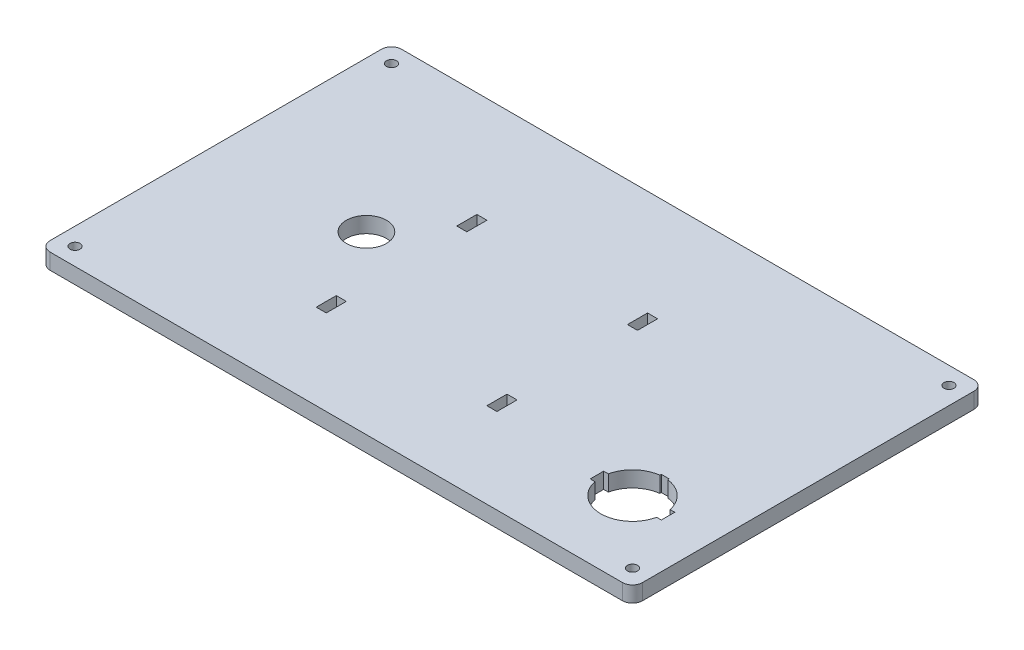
SolidWorks part; units mm, degrees
ref_plane "Front Plane" through (0, 0, 0) normal (0, 0, 1) x (1, 0, 0)
ref_plane "Top Plane" through (0, 0, 0) normal (0, 1, 0) x (1, 0, 0)
ref_plane "Right Plane" through (0, 0, 0) normal (1, 0, 0) x (0, 0, -1)
sketch "Sketch1" plane through (0, 0, 0) normal (0, 1, 0) x (1, 0, 0)
  line L1 (-90.4875, 55.5625) -> (90.4875, 55.5625)
  line L2 (-93.6625, 52.3875) -> (-93.6625, -52.3875)
  line L3 (-90.4875, -55.5625) -> (90.4875, -55.5625)
  line L4 (93.6625, 52.3875) -> (93.6625, -52.3875)
  line L5 (-93.6625, 55.5625) -> (93.6625, -55.5625) construction
  line L6 (-93.6625, -55.5625) -> (93.6625, 55.5625) construction
  line L7 (-88.138, 50.038) -> (88.138, 50.038) construction
  line L8 (-88.138, 50.038) -> (-88.138, -50.038) construction
  line L9 (-88.138, -50.038) -> (88.138, -50.038) construction
  line L10 (88.138, 50.038) -> (88.138, -50.038) construction
  line L11 (-88.138, 50.038) -> (88.138, -50.038) construction
  line L12 (-88.138, -50.038) -> (88.138, 50.038) construction
  circle A0 centre (-88.138, 50.038) radius 1.5875
  circle A1 centre (-88.138, -50.038) radius 1.5875
  circle A2 centre (88.138, -50.038) radius 1.5875
  circle A3 centre (88.138, 50.038) radius 1.5875
  arc A4 (-93.6625, -52.3875) -> (-90.4875, -55.5625) centre (-90.4875, -52.3875) ccw
  arc A5 (90.4875, -55.5625) -> (93.6625, -52.3875) centre (90.4875, -52.3875) ccw
  arc A6 (90.4875, 55.5625) -> (93.6625, 52.3875) centre (90.4875, 52.3875) cw
  arc A7 (-90.4875, 55.5625) -> (-93.6625, 52.3875) centre (-90.4875, 52.3875) ccw
  point P0 (0, 0)
  point P5 (0, 0)
  dimension "D5" = 3.175
  dimension "D6" = 3.175
  dimension "D1" = 111.125
  dimension "D2" = 187.325
  dimension "D3" = 100.076
  dimension "D4" = 176.276
extrude "Boss-Extrude1" add sketch "Sketch1" along normal blind 5
sketch "Sketch2" plane through (0, 5, 0) normal (0, 1, 0) x (1, 0, 0)
  line L1 (20.6375, -22.225) -> (23.8125, -22.225)
  line L2 (20.6375, -22.225) -> (20.6375, -28.575)
  line L3 (20.6375, -28.575) -> (23.8125, -28.575)
  line L4 (23.8125, -22.225) -> (23.8125, -28.575)
  line L5 (20.6375, 22.225) -> (23.8125, 22.225)
  line L6 (20.6375, 22.225) -> (20.6375, 15.875)
  line L7 (20.6375, 15.875) -> (23.8125, 15.875)
  line L8 (23.8125, 22.225) -> (23.8125, 15.875)
  line L9 (-33.3375, 22.225) -> (-30.1625, 22.225)
  line L10 (-33.3375, 22.225) -> (-33.3375, 15.875)
  line L11 (-33.3375, 15.875) -> (-30.1625, 15.875)
  line L12 (-30.1625, 22.225) -> (-30.1625, 15.875)
  line L13 (-33.3375, -22.225) -> (-30.1625, -22.225)
  line L14 (-33.3375, -22.225) -> (-33.3375, -28.575)
  line L15 (-33.3375, -28.575) -> (-30.1625, -28.575)
  line L16 (-30.1625, -22.225) -> (-30.1625, -28.575)
  dimension "D1" = 3.175
  dimension "D2" = 6.35
  dimension "D3" = 30.1625
  dimension "D4" = 38.1
  dimension "D5" = 15.875
  dimension "D6" = 50.8
extrude "Cut-Extrude1" cut sketch "Sketch2" against normal up to next
sketch "Sketch3" plane through (0, 5, 0) normal (0, 1, 0) x (1, 0, 0)
  line L0 (58.4908, -32.2872) -> (57.0128, -32.2872)
  line L1 (57.0128, -32.2872) -> (57.0128, -28.0378)
  line L2 (57.0128, -28.0378) -> (58.4908, -28.0378)
  line L3 (78.0342, -32.2872) -> (79.5122, -32.2872)
  line L4 (79.5122, -32.2872) -> (79.5122, -28.0378)
  line L5 (79.5122, -28.0378) -> (78.0342, -28.0378)
  line L6 (67.0128, -19.7866) -> (67.0128, -20.2409)
  line L7 (69.5122, -19.7866) -> (69.5122, -20.2409)
  line L8 (69.5122, -19.7866) -> (67.0128, -19.7866)
  line L9 (-90.4875, -55.5625) -> (90.4875, -55.5625) construction
  line L10 (93.6625, -52.3875) -> (93.6625, 52.3875) construction
  line L11 (-93.6625, 52.3875) -> (-93.6625, -52.3875) construction
  arc A0 (78.0342, -28.0378) -> (69.5122, -20.2409) centre (68.2625, -30.1625) ccw
  arc A1 (67.0128, -20.2409) -> (58.4908, -28.0378) centre (68.2625, -30.1625) ccw
  arc A2 (58.4908, -32.2872) -> (78.0342, -32.2872) centre (68.2625, -30.1625) ccw
  circle A3 centre (-46.0375, 0) radius 6.35
  point P14 (57.0128, -30.1625)
  point P15 (68.2625, -19.7866)
  point P23 (-93.6625, 0)
  dimension "D1" = 20
  dimension "D8" = 12.7
  dimension "D2" = 11.2497
  dimension "D3" = 4.2494
  dimension "D4" = 2.4994
  dimension "D5" = 10.3759
  dimension "D6" = 25.4
  dimension "D7" = 25.4
  dimension "D9" = 47.625
extrude "Cut-Extrude2" cut sketch "Sketch3" against normal up to next
